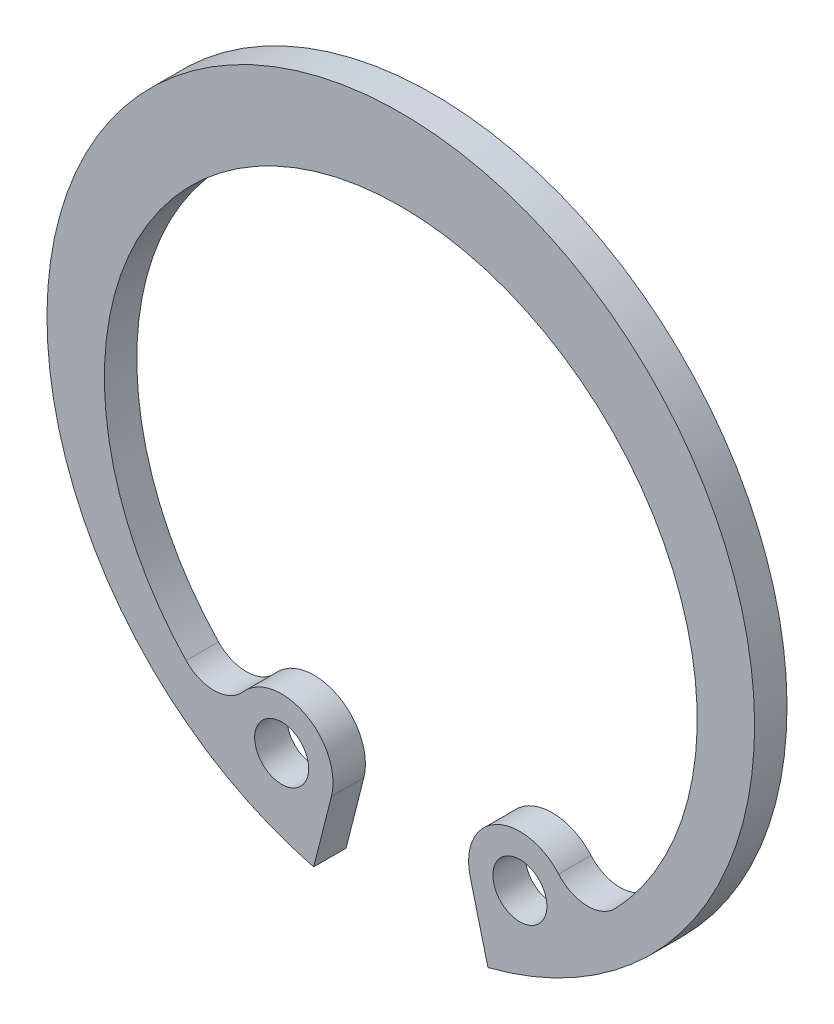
SolidWorks part; units mm, degrees
ref_plane "Plane1" through (0, 0, 0) normal (0, 0, 1) x (1, 0, 0)
ref_plane "Plane2" through (0, 0, 0) normal (0, 1, 0) x (1, 0, 0)
ref_plane "Plane3" through (0, 0, 0) normal (1, 0, 0) x (0, 0, -1)
sketch "Clipboard" plane through (0, 0, 0) normal (0, 0, 1) x (1, 0, 0)
  line L0 (0, 0) -> (3, 0)
  line L1 (0, 0) -> (0, 1.5)
  line L2 (0, 0) -> (0, -4.4)
  circle A0 centre (0, 0) radius 1
  circle A1 centre (0, 0) radius 12.5
  dimension "HoleDia" = 2
  dimension "BoreDia" = 25
  dimension "LargeSection" = 3
  dimension "SmallSection" = 1.5
  dimension "LugSection" = 4.4
sketch "BodySke" plane through (0, 0, 0) normal (0, 0, 1) x (1, 0, 0)
  line L0 (-1.5431, 0) -> (1.5431, 0) construction
  line L1 (0, 0) -> (0, 10.1) construction
  line L2 (3.2259, -12.6966) -> (2.568, -10.1072)
  line L3 (-3.2259, -12.6966) -> (-2.568, -10.1072)
  line L4 (0, 0) -> (8.9095, -9.6037) construction
  line L5 (0, 0) -> (-8.9095, -9.6037) construction
  line L6 (-4.1632, -8.6701) -> (-4.6557, -10.6085) construction
  line L7 (4.2246, -8.9118) -> (4.5943, -10.3668) construction
  arc A0 (-2.568, -10.1072) -> (-5.8432, -8.3926) centre (-4.4095, -9.6393) ccw
  arc A1 (5.8432, -8.3926) -> (2.568, -10.1072) centre (4.4095, -9.6393) ccw
  arc A2 (7.8894, -8.504) -> (-7.8894, -8.504) centre (0, -0.8748) ccw construction
  arc A3 (3.2259, -12.6966) -> (-3.2259, -12.6966) centre (0, 0) ccw
  circle A4 centre (4.4095, -9.6393) radius 1
  circle A5 centre (-4.4095, -9.6393) radius 1
  circle A6 centre (4.4095, -9.6393) radius 1.9 construction
  arc A7 (7.9509, -8.4398) -> (-7.9509, -8.4398) centre (0, -0.8748) ccw
  arc A8 (-4.4095, -9.6393) -> (4.4095, -9.6393) centre (0, 0) ccw construction
  arc A9 (-7.9509, -8.4398) -> (-5.8432, -8.3926) centre (-6.9186, -7.4576) ccw
  arc A10 (5.8432, -8.3926) -> (7.9509, -8.4398) centre (6.9186, -7.4576) ccw
  dimension "GrooveDia" = 26.2
  dimension "TipRad" = 1.9
  dimension "HoleOffsetRad" = 10.6
  dimension "HoleDia" = 2
  dimension "FilletRad" = 1.425
  dimension "LargeRad" = 10.1
  dimension "SmallRad" = 11.6
  dimension "SmallAngle" = 85.706
  dimension "GapAngle" = 28.511
extrude "Body" add sketch "BodySke" against normal blind 1.2
equation "' \"BoreDia@Clipboard\" = 10"
equation "' \"Thickness@Body\" = 1"
equation "' \"GrooveDia@BodySke\" = 10.4"
equation "' \"LugSection@Clipboard\" = 3.1"
equation "' \"LargeSection@Clipboard\" = 1.8"
equation "' \"HoleDia@Clipboard\" = 1.2"
equation "' \"BoreDia@Clipboard\" = 25"
equation "' \"Thickness@Body\" = 1.2"
equation "' \"GrooveDia@BodySke\" = 26.2"
equation "' \"LugSection@Clipboard\" = 4.4"
equation "' \"LargeSection@Clipboard\" = 3"
equation "' \"HoleDia@Clipboard\" = 2"
equation "\"SmallSection@Clipboard\" = \"LargeSection@Clipboard\" * 0.5"
equation "\"TipRad@BodySke\" = (\"LugSection@Clipboard\" - (\"GrooveDia@BodySke\" / 2  -  \"BoreDia@Clipboard\" / 2 ) ) / 2"
equation "\"HoleOffsetRad@BodySke\" = (\"GrooveDia@BodySke\" / 2) - \"LugSection@Clipboard\"  + \"TipRad@BodySke\""
equation "\"LargeRad@BodySke\" =  \"GrooveDia@BodySke\" / 2 -  \"LargeSection@Clipboard\""
equation "\"SmallRad@BodySke\" =  \"GrooveDia@BodySke\" / 2 -  \"SmallSection@Clipboard\""
equation "\"HoleDia@BodySke\" =  \"HoleDia@Clipboard\""
equation "\"FilletRad@BodySke\" = \"TipRad@BodySke\" * 0.75"
equation "\"GapAngle@BodySke\" = 360 - 0.965 * 360 * ( \"BoreDia@Clipboard\" /  \"GrooveDia@BodySke\")"
